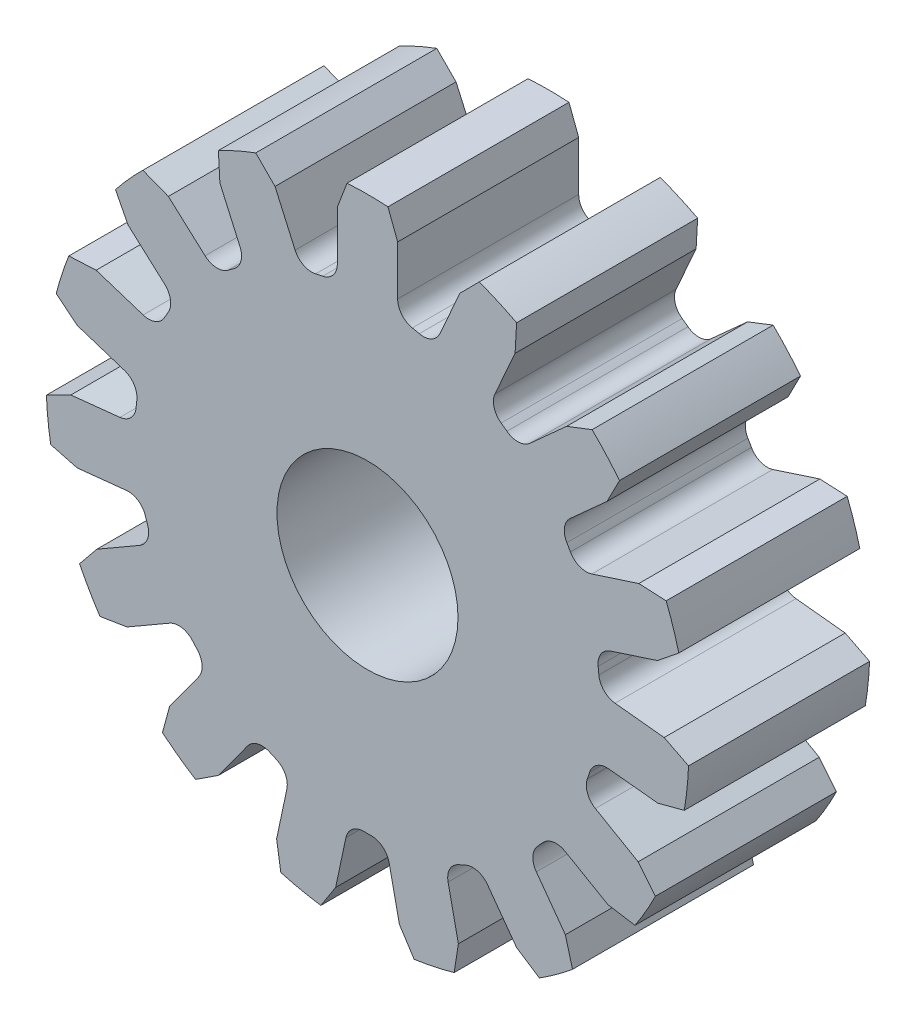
SolidWorks part; units mm, degrees
ref_plane "Plan de face" through (0, 0, 0) normal (0, 0, 1) x (1, 0, 0)
ref_plane "Plan de dessus" through (0, 0, 0) normal (0, 1, 0) x (1, 0, 0)
ref_plane "Plan de droite" through (0, 0, 0) normal (1, 0, 0) x (0, 0, -1)
sketch "Esquisse1" plane through (0, 0, 0) normal (0, 0, 1) x (1, 0, 0)
  circle A0 centre (0, 0) radius 5.325
  circle A1 centre (0, 0) radius 1.5
  dimension "D1" = 3
  dimension "D2" = 10.65
extrude "Extrusion1" add sketch "Esquisse1" along normal blind 3
sketch "Esquisse2" plane through (0, 0, 3) normal (0, 0, 1) x (1, 0, 0)
  line L0 (0, 0) -> (0, 5.9603) construction
  line L1 (-0.5, 5.9603) -> (-0.5, 1.6593) construction
  line L2 (-0.339, 5.3142) -> (-0.5, 4.8905)
  line L3 (-0.5, 4.8905) -> (-0.5, 4.0722)
  line L4 (0.5, 4.8905) -> (0.5, 4.0722)
  line L5 (0.339, 5.3142) -> (0.5, 4.8905)
  line L6 (1.8518, 4.9926) -> (1.5324, 4.6711)
  line L7 (1.5324, 4.6711) -> (1.1995, 3.9235)
  line L8 (2.4459, 4.2644) -> (2.1131, 3.5167)
  line L9 (2.4711, 4.7169) -> (2.4459, 4.2644)
  line L10 (3.7224, 3.8078) -> (3.2998, 3.644)
  line L11 (3.2998, 3.644) -> (2.6916, 3.0964)
  line L12 (3.9689, 2.9008) -> (3.3608, 2.3532)
  line L13 (4.176, 3.304) -> (3.9689, 2.9008)
  line L14 (4.9494, 1.9646) -> (4.4967, 1.9868)
  line L15 (4.4967, 1.9868) -> (3.7183, 1.7339)
  line L16 (4.8057, 1.0357) -> (4.0274, 0.7828)
  line L17 (5.1589, 1.3198) -> (4.8057, 1.0357)
  line L18 (5.3205, -0.2184) -> (4.916, -0.0139)
  line L19 (4.916, -0.0139) -> (4.1021, 0.0716)
  line L20 (4.8115, -1.0085) -> (3.9976, -0.9229)
  line L21 (5.2497, -0.8926) -> (4.8115, -1.0085)
  line L22 (4.7717, -2.3635) -> (4.4853, -2.0123)
  line L23 (4.4853, -2.0123) -> (3.7766, -1.6031)
  line L24 (3.9853, -2.8783) -> (3.2766, -2.4691)
  line L25 (4.4327, -2.9507) -> (3.9853, -2.8783)
  line L26 (3.3978, -4.1) -> (3.2791, -3.6626)
  line L27 (3.2791, -3.6626) -> (2.7981, -3.0006)
  line L28 (2.4701, -4.2504) -> (1.989, -3.5883)
  line L29 (2.8494, -4.4985) -> (2.4701, -4.2504)
  line L30 (1.4364, -5.1276) -> (1.5059, -4.6797)
  line L31 (1.5059, -4.6797) -> (1.3357, -3.8792)
  line L32 (0.5277, -4.8876) -> (0.3576, -4.0871)
  line L33 (0.7733, -5.2685) -> (0.5277, -4.8876)
  line L34 (-0.7733, -5.2685) -> (-0.5277, -4.8876)
  line L35 (-0.5277, -4.8876) -> (-0.3576, -4.0871)
  line L36 (-1.5059, -4.6797) -> (-1.3357, -3.8792)
  line L37 (-1.4364, -5.1276) -> (-1.5059, -4.6797)
  line L38 (-2.8494, -4.4985) -> (-2.4701, -4.2504)
  line L39 (-2.4701, -4.2504) -> (-1.989, -3.5883)
  line L40 (-3.2791, -3.6626) -> (-2.7981, -3.0006)
  line L41 (-3.3978, -4.1) -> (-3.2791, -3.6626)
  line L42 (-4.4327, -2.9507) -> (-3.9853, -2.8783)
  line L43 (-3.9853, -2.8783) -> (-3.2766, -2.4691)
  line L44 (-4.4853, -2.0123) -> (-3.7766, -1.6031)
  line L45 (-4.7717, -2.3635) -> (-4.4853, -2.0123)
  line L46 (-5.2497, -0.8926) -> (-4.8115, -1.0085)
  line L47 (-4.8115, -1.0085) -> (-3.9976, -0.9229)
  line L48 (-4.916, -0.0139) -> (-4.1021, 0.0716)
  line L49 (-5.3205, -0.2184) -> (-4.916, -0.0139)
  line L50 (-5.1589, 1.3198) -> (-4.8057, 1.0357)
  line L51 (-4.8057, 1.0357) -> (-4.0274, 0.7828)
  line L52 (-4.4967, 1.9868) -> (-3.7183, 1.7339)
  line L53 (-4.9494, 1.9646) -> (-4.4967, 1.9868)
  line L54 (-4.176, 3.304) -> (-3.9689, 2.9008)
  line L55 (-3.9689, 2.9008) -> (-3.3608, 2.3532)
  line L56 (-3.2998, 3.644) -> (-2.6916, 3.0964)
  line L57 (-3.7224, 3.8078) -> (-3.2998, 3.644)
  line L58 (-2.4711, 4.7169) -> (-2.4459, 4.2644)
  line L59 (-2.4459, 4.2644) -> (-2.1131, 3.5167)
  line L60 (-1.5324, 4.6711) -> (-1.1995, 3.9235)
  line L61 (-1.8518, 4.9926) -> (-1.5324, 4.6711)
  arc A0 (-0.7422, 3.7778) -> (-0.8586, 3.753) centre (0, 0) ccw
  circle A1 centre (0, 0) radius 5.325 construction
  arc A2 (5.2497, -0.8926) -> (5.3205, -0.2184) centre (0, 0) ccw
  arc A3 (-0.5, 4.0722) -> (-0.7422, 3.7778) centre (-0.8, 4.0722) cw
  arc A4 (0.5, 4.0722) -> (0.7422, 3.7778) centre (0.8, 4.0722) ccw
  arc A5 (1.1995, 3.9235) -> (0.8586, 3.753) centre (0.9255, 4.0455) cw
  arc A6 (2.1131, 3.5167) -> (2.2146, 3.1493) centre (2.3871, 3.3947) ccw
  arc A7 (2.6916, 3.0964) -> (2.3108, 3.0794) centre (2.4909, 3.3193) cw
  arc A8 (3.3608, 2.3532) -> (3.3041, 1.9763) centre (3.5615, 2.1303) ccw
  arc A9 (3.7183, 1.7339) -> (3.3635, 1.8732) centre (3.6256, 2.0192) cw
  arc A10 (4.0274, 0.7828) -> (3.8222, 0.4616) centre (4.1201, 0.4975) ccw
  arc A11 (4.1021, 0.0716) -> (3.8347, 0.3432) centre (4.1335, 0.37) cw
  arc A12 (3.9976, -0.9229) -> (3.6795, -1.133) centre (3.9662, -1.2213) ccw
  arc A13 (3.7766, -1.6031) -> (3.6427, -1.2462) centre (3.9266, -1.3433) cw
  arc A14 (3.2766, -2.4691) -> (2.9006, -2.5316) centre (3.1266, -2.7289) ccw
  arc A15 (2.7981, -3.0006) -> (2.821, -2.6201) centre (3.0408, -2.8242) cw
  arc A16 (1.989, -3.5883) -> (1.6201, -3.4925) centre (1.7463, -3.7647) ccw
  arc A17 (1.3357, -3.8792) -> (1.5114, -3.5409) centre (1.6292, -3.8168) cw
  arc A18 (0.3576, -4.0871) -> (0.0595, -3.8495) centre (0.0641, -4.1495) ccw
  arc A19 (-0.3576, -4.0871) -> (-0.0595, -3.8495) centre (-0.0641, -4.1495) cw
  arc A20 (-1.3357, -3.8792) -> (-1.5114, -3.5409) centre (-1.6292, -3.8168) ccw
  arc A21 (-1.989, -3.5883) -> (-1.6201, -3.4925) centre (-1.7463, -3.7647) cw
  arc A22 (-2.7981, -3.0006) -> (-2.821, -2.6201) centre (-3.0408, -2.8242) ccw
  arc A23 (-3.2766, -2.4691) -> (-2.9006, -2.5316) centre (-3.1266, -2.7289) cw
  arc A24 (-3.7766, -1.6031) -> (-3.6427, -1.2462) centre (-3.9266, -1.3433) ccw
  arc A25 (-3.9976, -0.9229) -> (-3.6795, -1.133) centre (-3.9662, -1.2213) cw
  arc A26 (-4.1021, 0.0716) -> (-3.8347, 0.3432) centre (-4.1335, 0.37) ccw
  arc A27 (-4.0274, 0.7828) -> (-3.8222, 0.4616) centre (-4.1201, 0.4975) cw
  arc A28 (-3.7183, 1.7339) -> (-3.3635, 1.8732) centre (-3.6256, 2.0192) ccw
  arc A29 (-3.3608, 2.3532) -> (-3.3041, 1.9763) centre (-3.5615, 2.1303) cw
  arc A30 (-2.6916, 3.0964) -> (-2.3108, 3.0794) centre (-2.4909, 3.3193) ccw
  arc A31 (-2.1131, 3.5167) -> (-2.2146, 3.1493) centre (-2.3871, 3.3947) cw
  arc A32 (-1.1995, 3.9235) -> (-0.8586, 3.753) centre (-0.9255, 4.0455) ccw
  arc A33 (0.8586, 3.753) -> (0, 3.85) centre (0, 0) ccw
  arc A34 (2.3108, 3.0794) -> (2.2146, 3.1493) centre (0, 0) ccw
  arc A35 (3.3635, 1.8732) -> (3.3041, 1.9763) centre (0, 0) ccw
  arc A36 (3.8347, 0.3432) -> (3.8222, 0.4616) centre (0, 0) ccw
  arc A37 (-3.3041, 1.9763) -> (-3.3635, 1.8732) centre (0, 0) ccw
  arc A38 (-2.2146, 3.1493) -> (-2.3108, 3.0794) centre (0, 0) ccw
  arc A39 (-3.8222, 0.4616) -> (-3.8347, 0.3432) centre (0, 0) ccw
  arc A40 (-3.6795, -1.133) -> (-3.6427, -1.2462) centre (0, 0) ccw
  arc A41 (-2.9006, -2.5316) -> (-2.821, -2.6201) centre (0, 0) ccw
  arc A42 (-1.6201, -3.4925) -> (-1.5114, -3.5409) centre (0, 0) ccw
  arc A43 (-0.0595, -3.8495) -> (0.0595, -3.8495) centre (0, 0) ccw
  arc A44 (1.5114, -3.5409) -> (1.6201, -3.4925) centre (0, 0) ccw
  arc A45 (2.821, -2.6201) -> (2.9006, -2.5316) centre (0, 0) ccw
  arc A46 (3.6427, -1.2462) -> (3.6795, -1.133) centre (0, 0) ccw
  arc A47 (5.1589, 1.3198) -> (4.9494, 1.9646) centre (0, 0) ccw
  arc A48 (4.176, 3.304) -> (3.7224, 3.8078) centre (0, 0) ccw
  arc A49 (2.4711, 4.7169) -> (1.8518, 4.9926) centre (0, 0) ccw
  arc A50 (0.339, 5.3142) -> (-0.5, 5.3015) centre (0, 0) ccw
  arc A51 (-1.8518, 4.9926) -> (-2.4711, 4.7169) centre (0, 0) ccw
  arc A52 (-3.7224, 3.8078) -> (-4.176, 3.304) centre (0, 0) ccw
  arc A53 (-4.9494, 1.9646) -> (-5.1589, 1.3198) centre (0, 0) ccw
  arc A54 (-5.3205, -0.2184) -> (-5.2497, -0.8926) centre (0, 0) ccw
  arc A55 (-4.7717, -2.3635) -> (-4.4327, -2.9507) centre (0, 0) ccw
  arc A56 (-3.3978, -4.1) -> (-2.8494, -4.4985) centre (0, 0) ccw
  arc A57 (-1.4364, -5.1276) -> (-0.7733, -5.2685) centre (0, 0) ccw
  arc A58 (0.7733, -5.2685) -> (1.4364, -5.1276) centre (0, 0) ccw
  arc A59 (2.8494, -4.4985) -> (3.3978, -4.1) centre (0, 0) ccw
  arc A60 (4.4327, -2.9507) -> (4.7717, -2.3635) centre (0, 0) ccw
  point P13 (-0.5, 3.8174)
  dimension "D1" = 7.7
  dimension "D3" = 0.3
  dimension "D2" = 0.5
extrude "Enlèv. mat.-Extru.1" cut sketch "Esquisse2" against normal through all flip side to cut
